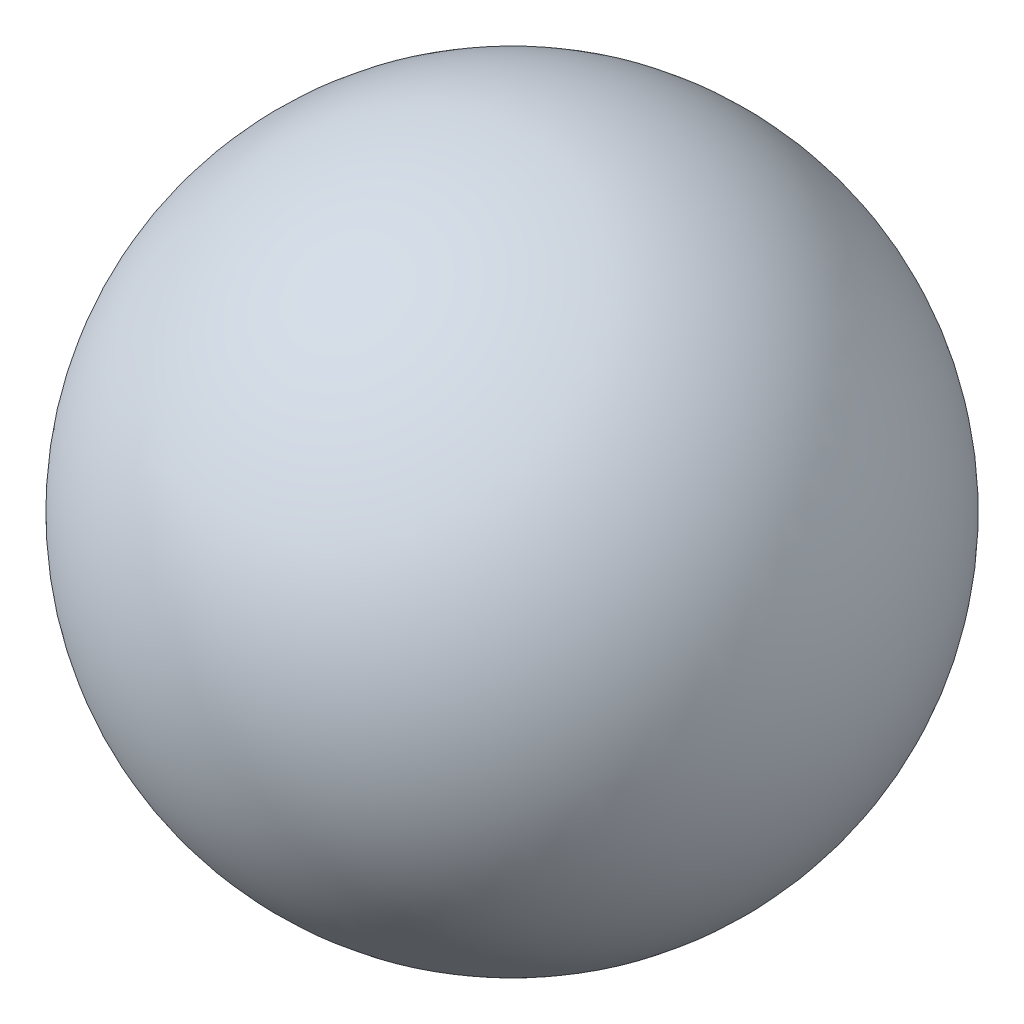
SolidWorks part; units mm, degrees
ref_plane "Plan de face" through (0, 0, 0) normal (0, 0, 1) x (1, 0, 0)
ref_plane "Plan de dessus" through (0, 0, 0) normal (0, 1, 0) x (1, 0, 0)
ref_plane "Plan de droite" through (0, 0, 0) normal (1, 0, 0) x (0, 0, -1)
sketch "Esquisse1" plane through (0, 0, 0) normal (0, 0, 1) x (1, 0, 0)
  line L0 (8.5, 31) -> (8.5, 12.5) construction
  line L1 (1.1, 31) -> (15.9, 31) construction
  line L2 (0, 29.9) -> (0, 13.6) construction
  line L3 (1.1, 12.5) -> (15.9, 12.5) construction
  line L4 (17, 29.9) -> (17, 13.6) construction
  line L5 (17, 25.45) -> (0, 25.45) construction
  line L6 (17, 18.05) -> (0, 18.05) construction
  line L7 (0, 0) -> (17, 0) construction
  line L8 (8.5, 27.3) -> (8.5, 16.2)
  arc A1 (0, 13.6) -> (1.1, 12.5) centre (1.1, 13.6) ccw construction
  arc A2 (1.1, 31) -> (0, 29.9) centre (1.1, 29.9) ccw construction
  arc A3 (17, 29.9) -> (15.9, 31) centre (15.9, 29.9) ccw construction
  arc A4 (15.9, 12.5) -> (17, 13.6) centre (15.9, 13.6) ccw construction
  arc A5 (8.5, 27.3) -> (8.5, 16.2) centre (8.5, 21.75) ccw
  dimension "D4" = 1.1
  dimension "D5" = 11.1
  dimension "D1" = 12.5
  dimension "D2" = 31
  dimension "D3" = 17
  dimension "D6" = 18.05
  dimension "D7" = 25.45
revolve "Révolution1" add sketch "Esquisse1" angle 360 about L0
